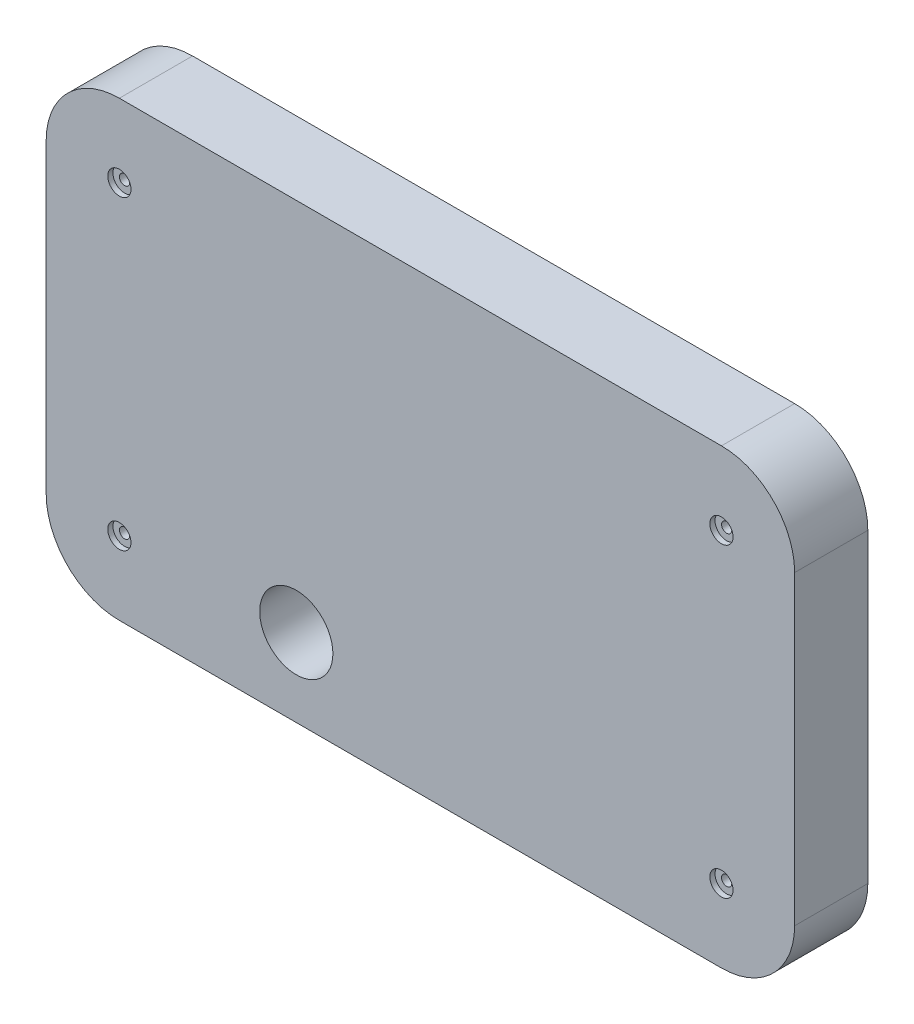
SolidWorks part; units mm, degrees
ref_plane "Front Plane" through (0, 0, 0) normal (0, 0, 1) x (1, 0, 0)
ref_plane "Top Plane" through (0, 0, 0) normal (0, 1, 0) x (1, 0, 0)
ref_plane "Right Plane" through (0, 0, 0) normal (1, 0, 0) x (0, 0, -1)
sketch "Sketch1" plane through (0, 0, 0) normal (0, 0, 1) x (1, 0, 0)
  line L1 (10, 0) -> (92.2726, 0)
  line L2 (0, 10) -> (0, 51.7988)
  line L3 (10, 61.7988) -> (92.2726, 61.7988)
  line L4 (102.2726, 10) -> (102.2726, 51.7988)
  arc A0 (10, 61.7988) -> (0, 51.7988) centre (10, 51.7988) ccw
  arc A1 (102.2726, 10) -> (92.2726, 0) centre (92.2726, 10) cw
  arc A2 (102.2726, 51.7988) -> (92.2726, 61.7988) centre (92.2726, 51.7988) ccw
  arc A3 (0, 10) -> (10, 0) centre (10, 10) ccw
  point P13 (0, 0)
  dimension "D1" = 10
extrude "Extrude1" add sketch "Sketch1" along normal blind 10
hole_wizard "CBORE for #00 Binding Head Machine Screw1" positions "Sketch3" profile "Sketch2" counterbore size "#00" standard "Ansi Inch"
sketch "Sketch3" plane through (0, 0, 10) normal (0, 0, 1) x (1, 0, 0)
  point P0 (10, 51.7988)
  point P1 (92.2726, 51.7988)
  point P4 (92.2726, 10)
  point P7 (10, 10)
sketch "Sketch2" plane through (10, 51.7988, 10) normal (1, 0, 0) x (0, -1, 0)
  line L0 (0, 0) -> (0, 10)
  line L1 (0, 10) -> (0.6985, 10)
  line L3 (0.6985, 10) -> (0.6985, 0.7112)
  line L4 (0.6985, 0.7112) -> (1.5875, 0.7112)
  line L5 (1.5875, 0.7112) -> (1.5875, 0)
  line L7 (1.5875, 0) -> (0, 0)
  line L11 (0, -6.35) -> (0, 107.95) construction
  dimension "Thru Hole Dia." = 1.397
  dimension "Thru Hole Depth" = 10
  dimension "C'Bore Dia." = 3.175
  dimension "C'Bore Depth" = 0.7112
other "Hole1"
sketch "Sketch4" plane through (0, 0, 10) normal (0, 0, 1) x (1, 0, 0)
  circle A0 centre (34.1764, 10.6578) radius 5
  dimension "D1" = 10
